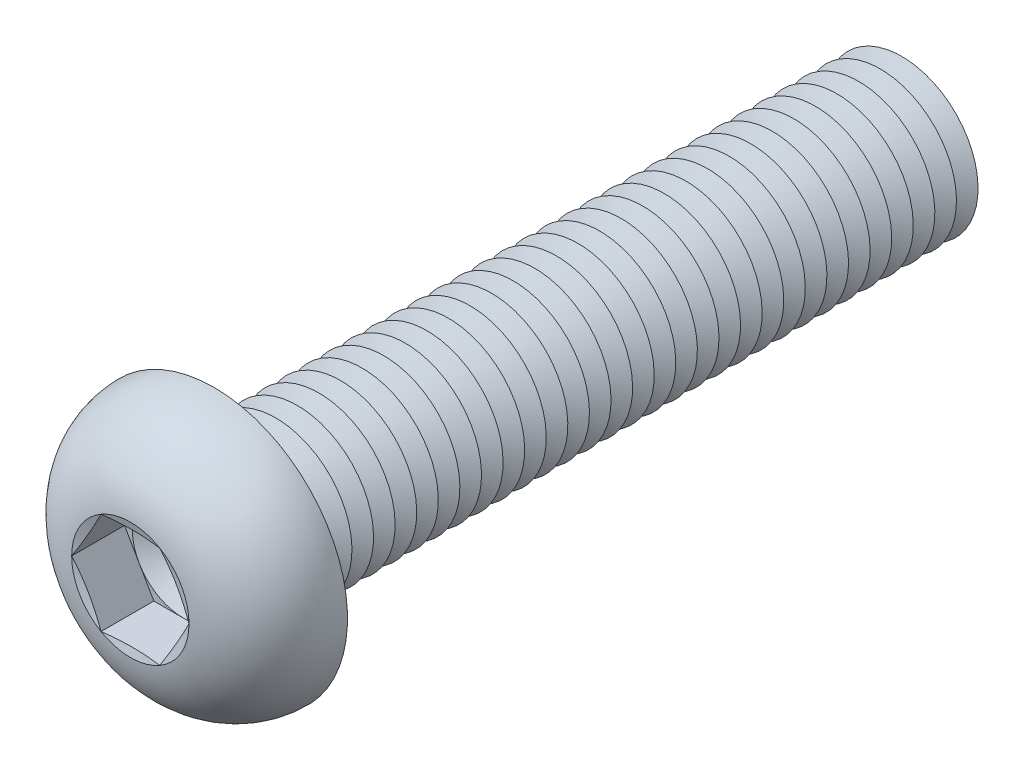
SolidWorks part; units mm, degrees
ref_plane "Front Plane" through (0, 0, 0) normal (0, 0, 1) x (1, 0, 0)
ref_plane "Top Plane" through (0, 0, 0) normal (0, 1, 0) x (1, 0, 0)
ref_plane "Right Plane" through (0, 0, 0) normal (1, 0, 0) x (0, 0, -1)
sketch "Sketch1" plane through (0, 0, 0) normal (1, 0, 0) x (0, 0, -1)
  line L0 (0, 6) -> (0, 10.5)
  line L3 (0, 6) -> (55, 6)
  line L4 (55, 6) -> (55, 0)
  line L5 (55, 0) -> (-6.6, 0) construction
  line L6 (-6.6, 0) -> (55, 0)
  line L7 (-6.6, 4.6188) -> (-6.6, 2.3094) construction
  line L8 (-6.6, 2.3094) -> (-6.6, 0)
  line L9 (-6.6, 4.6188) -> (-5.9812, 2.3094)
  line L10 (-5.9812, 2.3094) -> (-6.6, 2.3094)
  line L11 (55, 0) -> (22.7481, 0) construction
  line L12 (0, 10.5) -> (-6.6, 10.5) construction
  arc A1 (0, 10.5) -> (-6.6, 4.6188) centre (0, 3.8561) ccw
  point P8 (55, 3)
  dimension "D1" = 21
  dimension "D2" = 12
  dimension "D3" = 6.6
  dimension "D4" = 9.2376
  dimension "D5" = 55
  dimension "D6" = 15
revolve "Revolve1" add sketch "Sketch1" angle 360 about L5
fillet "Fillet1" radius 0.85 1 edges at (0, 6, 0)
sketch "Sketch2" plane through (0, 0, 0) normal (1, 0, 0) x (0, 0, -1)
  line L0 (54.15, 6) -> (55.85, 6)
  line L1 (55, 6) -> (0.85, 6) construction
  line L2 (55.85, 6) -> (55, 4.5278)
  line L3 (55, -6) -> (55, 6) construction
  line L4 (55, 4.5278) -> (54.15, 6)
  dimension "D1" = 1.7
revolve "Cut-Revolve1" cut sketch "Sketch2" angle 360 about axis through (0, 0, -55) along (0, 0, -1)
pattern_linear "LPattern1" count 32 spacing 1.7 along (0, 0, 1) of "Cut-Revolve1"
sketch "Sketch3" plane through (0, 0, 6.6) normal (0, 0, 1) x (1, 0, 0)
  line L7 (2.3094, 4) -> (-2.3094, 4)
  line L8 (-2.3094, 4) -> (-4.6188, 0)
  line L9 (-4.6188, 0) -> (-2.3094, -4)
  line L10 (-2.3094, -4) -> (2.3094, -4)
  line L11 (2.3094, -4) -> (4.6188, 0)
  line L12 (4.6188, 0) -> (2.3094, 4)
  circle A0 centre (0, 0) radius 4 construction
  circle A3 centre (0, 0) radius 4.6188 construction
extrude "Cut-Extrude1" cut sketch "Sketch3" against normal blind 4.16
sketch "Sketch4" plane through (0, 0, 2.44) normal (0, 0, 1) x (1, 0, 0)
  line L1 (2.3094, 4) -> (-2.3094, 4) construction
  circle A0 centre (0, 0) radius 4
extrude "Cut-Extrude2" cut sketch "Sketch4" against normal through all draft 60
